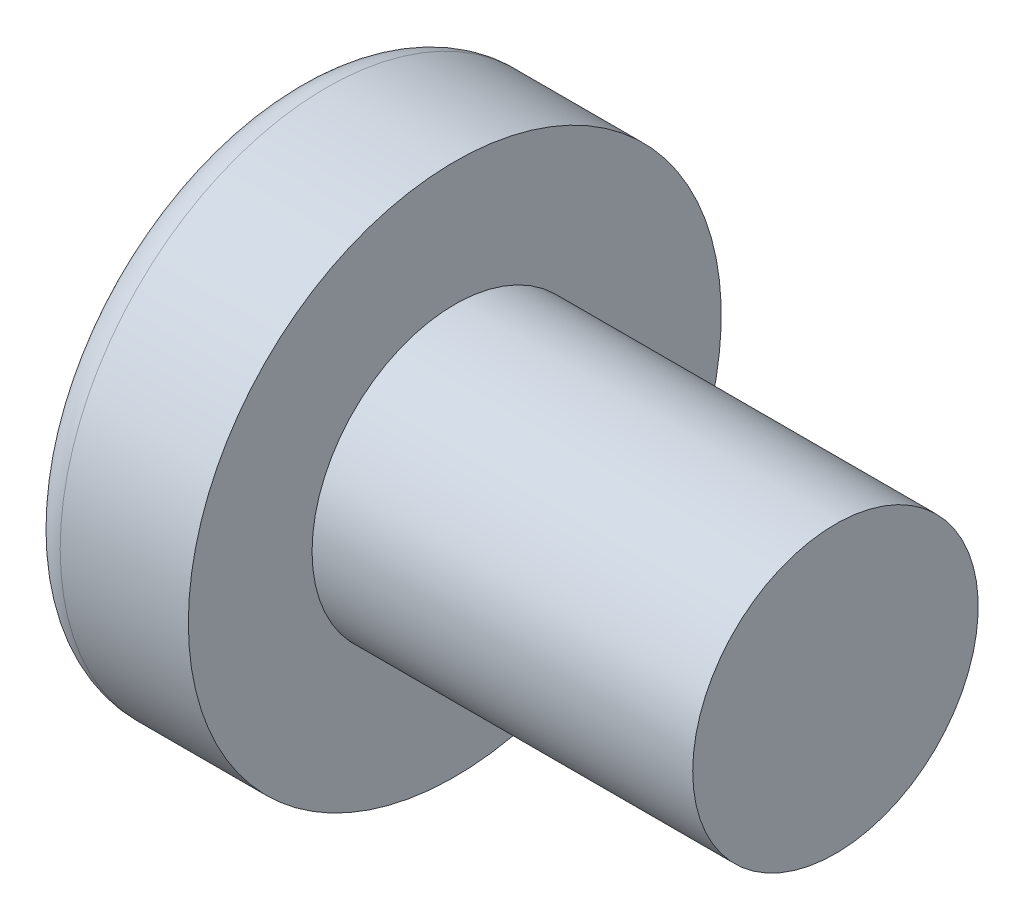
SolidWorks part; units mm, degrees
ref_plane "Plane1" through (0, 0, 0) normal (0, 0, 1) x (1, 0, 0)
ref_plane "Plane2" through (0, 0, 0) normal (0, 1, 0) x (1, 0, 0)
ref_plane "Plane3" through (0, 0, 0) normal (1, 0, 0) x (0, 0, -1)
sketch "BodySke" plane through (0, 0, 0) normal (0, 0, 1) x (1, 0, 0)
  line L0 (2.4, 1.5) -> (2.4, 2.8)
  line L1 (2.9, 6.35) -> (2.9, -3.175) construction
  line L2 (-25.4, 0) -> (127, 0) construction
  line L3 (6.4, 0) -> (0, 0)
  line L4 (2.4, 1.5) -> (6.4, 1.5)
  line L5 (6.4, 1.5) -> (6.4, 0)
  line L6 (1.0534, 2.8) -> (2.4, 2.8)
  line L7 (2.4, -1.5) -> (6.4, -1.5) construction
  line L8 (2.4, 6.35) -> (2.4, -3.175) construction
  arc A0 (0.7472, 2.6293) -> (0, 0) centre (5, 0) ccw
  arc A2 (0.7472, 2.6293) -> (1.0534, 2.8) centre (1.0534, 2.44) cw
  dimension "Head_fillet_rad" = 0.36
  dimension "Head_crown_rad" = 5
  dimension "Head_ht" = 2.4
  dimension "Diameter" = 3
  dimension "Length" = 4
  dimension "Head_dia" = 5.6
  dimension "Advance" = 0.5
  dimension "Thread_nom" = 4
revolve "Base-Revolve" add sketch "BodySke" angle 360 about L2
sketch "Sketch3" plane through (0, 0, 0) normal (1, 0, 0) x (0, 0, -1)
  line L0 (0.37, -1.45) -> (-0.37, -1.45)
  line L1 (0.37, -1.45) -> (0.37, 1.45)
  line L2 (-0.37, 1.45) -> (0.37, 1.45)
  line L3 (-0.37, 1.45) -> (-0.37, -1.45)
  dimension "D1" = 1.45
  dimension "Cross_dia" = 2.9
  dimension "D2" = 0.37
  dimension "Cross_width" = 0.74
ref_plane "Plane4" through (1.76, 0, 0) normal (1, 0, 0) x (0, 0, -1)
sketch "Sketch4" plane through (1.76, 0, 0) normal (1, 0, 0) x (0, 0, -1)
  line L0 (0.185, -0.185) -> (-0.185, -0.185)
  line L1 (0.185, -0.185) -> (0.185, 0.185)
  line L2 (-0.185, 0.185) -> (0.185, 0.185)
  line L3 (-0.185, 0.185) -> (-0.185, -0.185)
  dimension "D1" = 0.37
  dimension "D2" = 0.37
  dimension "D3" = 0.185
  dimension "D4" = 0.185
loft "Cut-Loft1" cut profiles "Sketch3", "Sketch4"
pattern_circular "CirPattern1" count 2 every 90 about axis through (0, 0, 0) along (1, 0, 0) of "Cut-Loft1"
sketch "ThdSchSke" plane through (0, 0, 0) normal (0, 0, 1) x (1, 0, 0)
  line L0 (2.9, -1.2195) -> (2.7036, -1.5)
  line L1 (2.9, -1.2195) -> (3.0964, -1.5)
  line L2 (3.0964, -1.5) -> (3.0964, -1.875)
  line L3 (-3.175, 0) -> (5.1513, 0) construction
  line L5 (3.0964, -1.875) -> (2.7036, -1.875)
  line L6 (2.7036, -1.875) -> (2.7036, -1.5)
  dimension "Thread_minor" = 2.439
  dimension "Diameter" = 3
  dimension "Start" = 2.9
  dimension "SideAngle" = 55
  dimension "VeeAngle" = 70
  dimension "Overcut" = 3.75
revolve "ThreadSchematic" [suppressed] cut sketch "ThdSchSke" angle 360 about L3
pattern_linear "ThdSchPat" [suppressed]
equation "\"D1@Sketch3\" = \"Cross_dia@Sketch3\" / 2"
equation "\"D2@Sketch3\" = \"Cross_width@Sketch3\" / 2"
equation "\"D1@Sketch4\" = \"Cross_width@Sketch3\" *.5"
equation "\"D2@Sketch4\" = \"D1@Sketch4\""
equation "\"D3@Sketch4\" = \"D1@Sketch4\" / 2"
equation "\"D4@Sketch4\" = \"D2@Sketch4\" / 2"
equation "\"Thread_length@ThreadCosmetic\" = ((sgn( (\"Length@BodySke\" - \"Advance@BodySke\" ) - \"Thread_nom@BodySke\" )-1)*( (\"Length@BodySke\" - \"Advance@BodySke\" ) - \"Thread_nom@BodySke\" ))/-2+ \"Thread_nom@BodySke\""
equation "\"Thread_minor@ThdSchSke\" = \"Thread_minor@ThreadCosmetic\""
equation "\"Diameter@ThdSchSke\" = \"Diameter@BodySke\""
equation "\"Overcut@ThdSchSke\" = \"Diameter@BodySke\" * 1.25"
equation "\"Start@ThdSchSke\" = \"Head_ht@BodySke\" + \"Length@BodySke\" - \"Thread_length@ThreadCosmetic\"  '---Non-countersunk---"
equation "\"Num_threads@ThdSchPat\" = int( \"Thread_length@ThreadCosmetic\" / \"Advance@BodySke\" + 0.999 )  + 1"
equation "\"Advance@ThdSchPat\" = \"Thread_length@ThreadCosmetic\" /  (\"Num_threads@ThdSchPat\" - 1) 'relax it"
